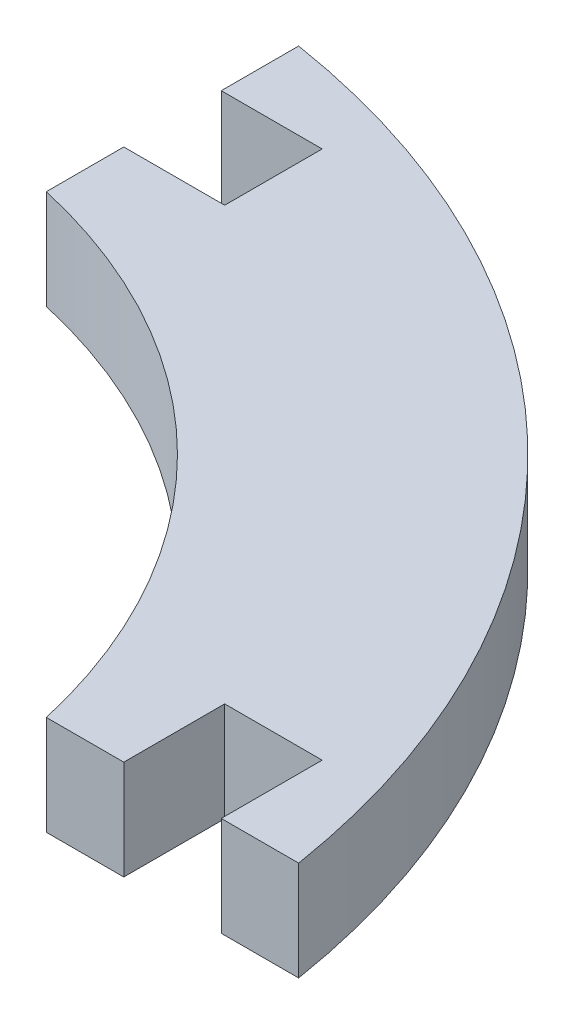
SolidWorks part; units mm, degrees
ref_plane "Front Plane" through (0, 0, 0) normal (0, 0, 1) x (1, 0, 0)
ref_plane "Top Plane" through (0, 0, 0) normal (0, 1, 0) x (1, 0, 0)
ref_plane "Right Plane" through (0, 0, 0) normal (1, 0, 0) x (0, 0, -1)
sketch "Sketch1" plane through (0, 0, 0) normal (0, 1, 0) x (1, 0, 0)
  line L0 (-14.362, 0) -> (33.8292, 0) construction
  line L1 (-14.362, 0) -> (-14.362, 39.7265) construction
  line L2 (19.1615, 0) -> (14.291, 0)
  line L3 (-14.362, 33.5235) -> (-14.362, 28.6531)
  line L4 (-17.537, 36.5906) -> (-8.012, 36.5906) construction
  line L5 (-8.012, 33.5235) -> (-8.012, 39.6576)
  line L6 (-8.012, 39.6576) -> (-14.362, 39.6576)
  line L7 (-8.012, 33.5235) -> (-14.362, 33.5235)
  line L9 (22.2285, 1.9269) -> (22.2285, 9.6366) construction
  line L10 (19.1615, 0) -> (19.1615, 6.35)
  line L11 (19.1615, 6.35) -> (25.2956, 6.35)
  line L12 (25.2956, 0) -> (25.2956, 6.35)
  line L14 (-14.362, 44.5281) -> (-14.362, 39.6576)
  line L15 (30.166, 0) -> (25.2956, 0)
  arc A0 (-14.362, 44.5281) -> (30.166, 0) centre (-22.8512, -8.4892) cw
  arc A1 (-14.362, 28.6531) -> (14.291, 0) centre (-22.8512, -8.4892) cw
  point P22 (22.2285, 6.35)
  dimension "D3" = 38.1
  dimension "D1" = 15.875
  dimension "D2" = 7.9375
extrude "Boss-Extrude1" add sketch "Sketch1" along normal blind 6.2611
equation "\"slot_width\"=0.2465"
equation "\"slot_depth\"= 0.25    "
equation "\"half_slot_width\"= \"slot_width\" /2"
equation "\"D2@Sketch1\" = \"D1@Sketch1\"/2"
equation "\"press_fit_width\"= \"slot_width\"-0.005"
